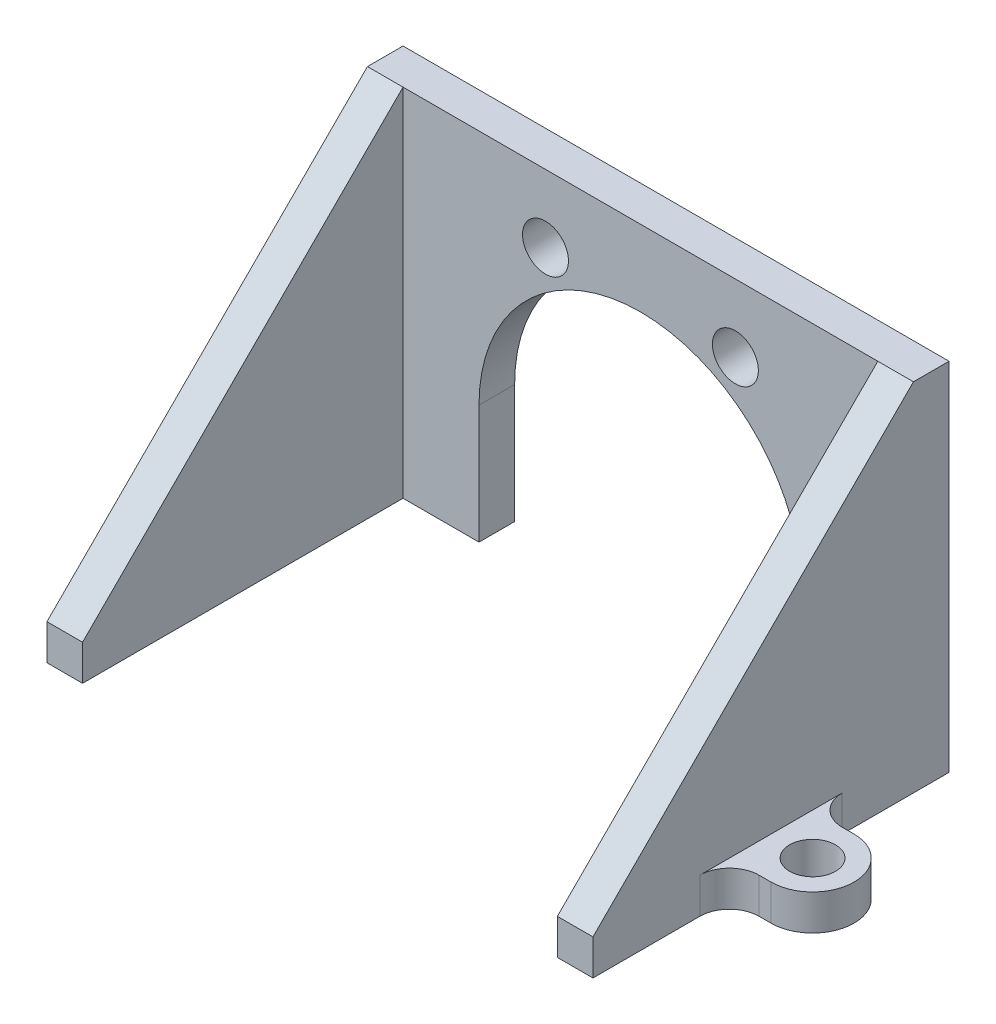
SolidWorks part; units mm, degrees
ref_plane "Front Plane" through (0, 0, 0) normal (0, 0, 1) x (1, 0, 0)
ref_plane "Top Plane" through (0, 0, 0) normal (0, 1, 0) x (1, 0, 0)
ref_plane "Right Plane" through (0, 0, 0) normal (1, 0, 0) x (0, 0, -1)
sketch "Sketch1" plane through (0, 0, 0) normal (1, 0, 0) x (0, 0, -1)
  line L0 (0, 0) -> (0, 38.1)
  line L1 (0, 38.1) -> (-3.81, 38.1)
  line L2 (-3.81, 38.1) -> (-38.1, 3.81)
  line L3 (-38.1, 3.81) -> (-38.1, 0)
  line L4 (-38.1, 0) -> (0, 0)
  dimension "D1" = 3.81
  dimension "D2" = 3.81
  dimension "D3" = 38.1
  dimension "D4" = 38.1
extrude "Boss-Extrude1" add sketch "Sketch1" along normal mid plane 58.42
sketch "Sketch2" plane through (0, 0, 38.1) normal (0, 0, -1) x (1, 0, 0)
  line L0 (29.21, -38.1) -> (-29.21, -38.1) construction
  line L1 (-25.4, -38.1) -> (25.4, -38.1)
  line L2 (-25.4, -38.1) -> (-25.4, 0)
  line L3 (-25.4, 0) -> (25.4, 0)
  line L4 (25.4, -38.1) -> (25.4, 0)
  line L6 (0, -3.81) -> (0, 0) construction
  line L8 (-29.21, -3.81) -> (-29.21, 0) construction
  dimension "D1" = 3.81
extrude "Cut-Extrude1" cut sketch "Sketch2" along normal up to vertex (34.29 mm away)
sketch "Sketch3" plane through (0, 0, 0) normal (0, -1, 0) x (1, 0, 0)
  line L0 (29.21, 19.05) -> (-34.4494, 19.05) construction
  line L1 (29.21, 38.1) -> (29.21, 0) construction
  line L3 (-29.21, 38.1) -> (-29.21, 0) construction
  line L4 (-33.655, 23.495) -> (-29.21, 23.495)
  line L5 (-33.655, 14.605) -> (-29.21, 14.605)
  line L6 (-29.21, 14.605) -> (-29.21, 23.495)
  line L7 (0, 0) -> (0, 48.4096) construction
  line L8 (29.21, 14.605) -> (29.21, 23.495)
  line L9 (33.655, 14.605) -> (29.21, 14.605)
  line L10 (33.655, 23.495) -> (29.21, 23.495)
  arc A0 (-33.655, 23.495) -> (-33.655, 14.605) centre (-33.655, 19.05) ccw
  arc A1 (33.655, 23.495) -> (33.655, 14.605) centre (33.655, 19.05) cw
  dimension "D1" = 8.89
extrude "Boss-Extrude2" add sketch "Sketch3" against normal blind 3.81
fillet "Fillet1" radius 3.175 4 edges
hole_wizard "#10 (0.1935) Diameter Hole1" positions "Sketch5" profile "Sketch4" hole size "#10" standard "ANSI Inch"
sketch "Sketch5" plane through (0, 3.81, 0) normal (0, 1, 0) x (1, 0, 0)
  arc A0 (33.655, -23.495) -> (33.655, -14.605) centre (33.655, -19.05) ccw construction
  arc A1 (-33.655, -14.605) -> (-33.655, -23.495) centre (-33.655, -19.05) ccw construction
  point P0 (-33.655, -19.05)
  point P2 (33.655, -19.05)
sketch "Sketch4" plane through (-33.655, 3.81, 19.05) normal (1, 0, 0) x (0, 0, 1)
  line L0 (0, 0) -> (0, 3.81)
  line L1 (0, 3.81) -> (2.4574, 3.81)
  line L2 (2.4574, 3.81) -> (2.4574, 0)
  line L5 (2.4574, 0) -> (0, 0)
  line L11 (0, -6.35) -> (0, 107.95) construction
  dimension "Thru Hole Dia." = 4.9149
  dimension "Thru Hole Depth" = 3.81
sketch "Sketch6" plane through (0, 0, 0) normal (0, 0, -1) x (-1, 0, 0)
  line L0 (17.272, 12.7) -> (17.272, 0)
  line L2 (17.272, 0) -> (-17.272, 0)
  line L3 (-17.272, 0) -> (-17.272, 12.7)
  arc A0 (17.272, 12.7) -> (-17.272, 12.7) centre (0, 12.7) ccw
  dimension "D1" = 17.272
  dimension "D2" = 12.7
extrude "Cut-Extrude2" cut sketch "Sketch6" against normal through all
hole_wizard "#10 (0.1935) Diameter Hole2" positions "Sketch8" profile "Sketch7" hole size "#10" standard "ANSI Inch"
sketch "Sketch8" plane through (0, 0, 0) normal (0, 0, -1) x (-1, 0, 0)
  line L0 (-10.16, 30.8454) -> (10.16, 30.8454) construction
  point P0 (-10.16, 30.8454)
  point P2 (10.16, 30.8454)
  dimension "D1" = 20.32
sketch "Sketch7" plane through (10.16, 30.8454, 0) normal (1, 0, 0) x (0, 1, 0)
  line L0 (0, 0) -> (0, 38.1)
  line L1 (0, 38.1) -> (2.4574, 38.1)
  line L2 (2.4574, 38.1) -> (2.4574, 0)
  line L5 (2.4574, 0) -> (0, 0)
  line L11 (0, -6.35) -> (0, 107.95) construction
  dimension "Thru Hole Dia." = 4.9149
  dimension "Thru Hole Depth" = 38.1
